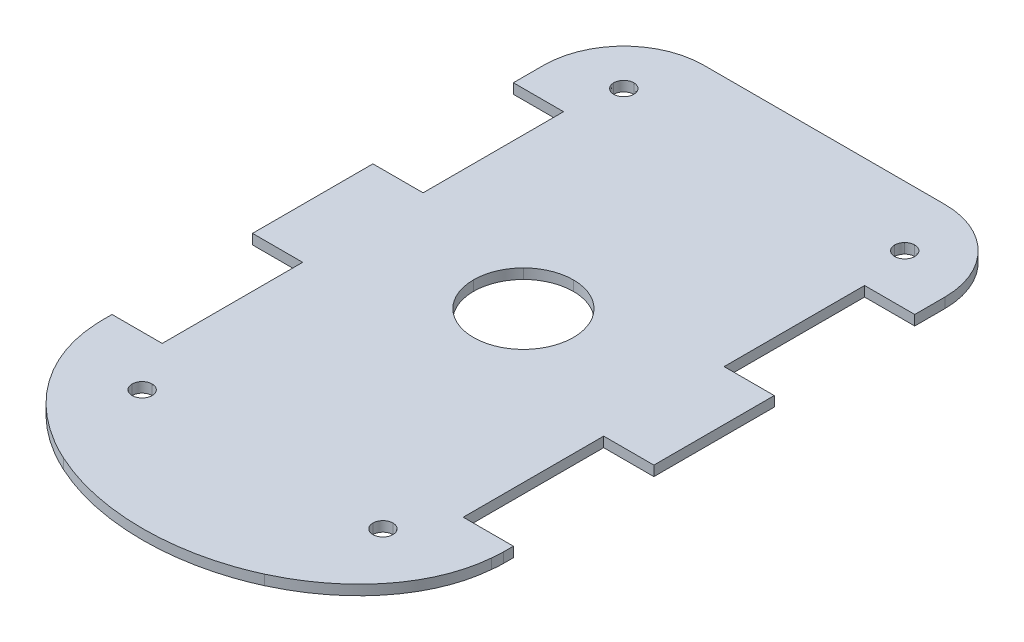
SolidWorks part; units mm, degrees
ref_plane "Front Plane" through (0, 0, 0) normal (0, 0, 1) x (1, 0, 0)
ref_plane "Top Plane" through (0, 0, 0) normal (0, 1, 0) x (1, 0, 0)
ref_plane "Right Plane" through (0, 0, 0) normal (1, 0, 0) x (0, 0, -1)
sketch "Model" plane through (0, 0, 0) normal (0, 1, 0) x (1, 0, 0)
  line L0 (50, 360) -> (50, 344.9999)
  line L1 (50, 344.9999) -> (75.0001, 344.9999)
  line L2 (75.0001, 344.9999) -> (75.0001, 275.0001)
  line L3 (75.0001, 275.0001) -> (50, 275.0001)
  line L4 (50, 275.0001) -> (50, 215.0001)
  line L5 (50, 215.0001) -> (75.0001, 215.0001)
  line L6 (75.0001, 215.0001) -> (75.0001, 145.0003)
  line L7 (75.0001, 145.0003) -> (50, 145.0003)
  line L8 (50, 145.0003) -> (50, 140)
  line L9 (250.0002, 140) -> (250.0002, 144.9997)
  line L10 (250.0002, 144.9997) -> (225.0002, 144.9997)
  line L11 (225.0002, 144.9997) -> (225.0002, 215.0001)
  line L12 (225.0002, 215.0001) -> (250.0002, 215.0001)
  line L13 (250.0002, 215.0001) -> (250.0002, 275.0001)
  line L14 (250.0002, 275.0001) -> (225.0002, 275.0001)
  line L15 (225.0002, 275.0001) -> (225.0002, 344.9999)
  line L16 (225.0002, 344.9999) -> (250.0002, 344.9999)
  line L17 (250.0002, 344.9999) -> (250.0002, 360)
  line L18 (210.0001, 400.0002) -> (90.0002, 400.0002)
  spline S0 degree 3 poles (90.0002, 400.0002) (67.8402, 400.0002) (50, 382.16) (50, 360) knots 0 0 0 0 1 1 1 1
  spline S1 degree 3 poles (50, 140) (50, 139.0331) (50.0361, 138.0747) (50.1029, 137.1253) knots 0 0 0 0 1 1 1 1
  spline S2 degree 3 poles (50.1029, 137.1253) (51.3405, 109.6636) (70.1944, 84.6422) (100.0068, 70.8968) knots 0 0 0 0 1 1 1 1
  spline S3 degree 3 poles (100.0068, 70.8968) (130.9402, 56.6423) (169.0518, 56.6423) (199.9852, 70.8968) knots 0 0 0 0 1 1 1 1
  spline S4 degree 3 poles (199.9852, 70.8968) (228.7711, 84.2016) (247.3811, 108.062) (249.6323, 134.5508) knots 0 0 0 0 1 1 1 1
  spline S5 degree 3 poles (249.6323, 134.5508) (249.873, 136.3321) (250.0002, 138.1506) (250.0002, 140) knots 0 0 0 0 1 1 1 1
  spline S6 degree 3 poles (250.0002, 360) (250.0002, 382.16) (232.1601, 400.0002) (210.0001, 400.0002) knots 0 0 0 0 1 1 1 1
  spline S7 degree 3 poles (79.9998, 375.0002) (81.3259, 375.0002) (82.5978, 374.4734) (83.5355, 373.5357) knots 0 0 0 0 1 1 1 1
  spline S8 degree 3 poles (83.5355, 373.5357) (84.4732, 372.598) (85, 371.3261) (85, 370) knots 0 0 0 0 1 1 1 1
  spline S9 degree 3 poles (85, 370) (84.9998, 367.2386) (82.7612, 365.0001) (79.9998, 365.0003) knots 0 0 0 0 1 1 1 1
  spline S10 degree 3 poles (79.9998, 365.0003) (77.2386, 365.0004) (75.0002, 367.2388) (75.0001, 370) knots 0 0 0 0 1 1 1 1
  spline S11 degree 3 poles (75.0001, 370) (75, 372.7613) (77.2384, 375) (79.9998, 375.0002) knots 0 0 0 0 1 1 1 1
  spline S12 degree 3 poles (220, 375.0002) (221.3262, 375.0002) (222.598, 374.4734) (223.5358, 373.5357) knots 0 0 0 0 1 1 1 1
  spline S13 degree 3 poles (223.5358, 373.5357) (224.4735, 372.598) (225.0003, 371.3261) (225.0002, 370) knots 0 0 0 0 1 1 1 1
  spline S14 degree 3 poles (225.0002, 370) (225, 367.2386) (222.7614, 365.0001) (220, 365.0003) knots 0 0 0 0 1 1 1 1
  spline S15 degree 3 poles (220, 365.0003) (217.2386, 365.0001) (215, 367.2386) (214.9998, 370) knots 0 0 0 0 1 1 1 1
  spline S16 degree 3 poles (214.9998, 370) (214.9997, 371.3261) (215.5265, 372.598) (216.4643, 373.5357) knots 0 0 0 0 1 1 1 1
  spline S17 degree 3 poles (216.4643, 373.5357) (217.402, 374.4734) (218.6738, 375.0002) (220, 375.0002) knots 0 0 0 0 1 1 1 1
  spline S18 degree 3 poles (150.0001, 274.8797) (163.7407, 274.8796) (174.8797, 263.7406) (174.8798, 250) knots 0 0 0 0 1 1 1 1
  spline S19 degree 3 poles (174.8798, 250) (174.8797, 236.2594) (163.7407, 225.1205) (150.0001, 225.1204) knots 0 0 0 0 1 1 1 1
  spline S20 degree 3 poles (150.0001, 225.1204) (143.4016, 225.1203) (137.0733, 227.7415) (132.4073, 232.4074) knots 0 0 0 0 1 1 1 1
  spline S21 degree 3 poles (132.4073, 232.4074) (127.7414, 237.0732) (125.1201, 243.4015) (125.12, 250) knots 0 0 0 0 1 1 1 1
  spline S22 degree 3 poles (125.12, 250) (125.1201, 256.5986) (127.7414, 262.9269) (132.4073, 267.5927) knots 0 0 0 0 1 1 1 1
  spline S23 degree 3 poles (132.4073, 267.5927) (137.0733, 272.2586) (143.4016, 274.8798) (150.0001, 274.8797) knots 0 0 0 0 1 1 1 1
  spline S24 degree 3 poles (90.0002, 124.9999) (92.7614, 124.9998) (94.9997, 122.7614) (94.9999, 120.0002) knots 0 0 0 0 1 1 1 1
  spline S25 degree 3 poles (94.9999, 120.0002) (95, 117.2388) (92.7616, 115.0002) (90.0002, 115) knots 0 0 0 0 1 1 1 1
  spline S26 degree 3 poles (90.0002, 115) (88.674, 114.9999) (87.4022, 115.5267) (86.4644, 116.4645) knots 0 0 0 0 1 1 1 1
  spline S27 degree 3 poles (86.4644, 116.4645) (85.5267, 117.4022) (84.9999, 118.6741) (85, 120.0002) knots 0 0 0 0 1 1 1 1
  spline S28 degree 3 poles (85, 120.0002) (85.0001, 122.7616) (87.2388, 125) (90.0002, 124.9999) knots 0 0 0 0 1 1 1 1
  spline S29 degree 3 poles (210.0001, 124.9999) (212.7613, 124.9998) (214.9996, 122.7614) (214.9998, 120.0002) knots 0 0 0 0 1 1 1 1
  spline S30 degree 3 poles (214.9998, 120.0002) (214.9999, 117.2388) (212.7615, 115.0002) (210.0001, 115) knots 0 0 0 0 1 1 1 1
  spline S31 degree 3 poles (210.0001, 115) (208.6739, 114.9999) (207.4021, 115.5267) (206.4643, 116.4645) knots 0 0 0 0 1 1 1 1
  spline S32 degree 3 poles (206.4643, 116.4645) (205.5266, 117.4022) (204.9998, 118.6741) (204.9999, 120.0002) knots 0 0 0 0 1 1 1 1
  spline S33 degree 3 poles (204.9999, 120.0002) (205.0001, 122.7616) (207.2387, 125) (210.0001, 124.9999) knots 0 0 0 0 1 1 1 1
extrude "Boss-Extrude1" add sketch "Model" along normal blind 5
